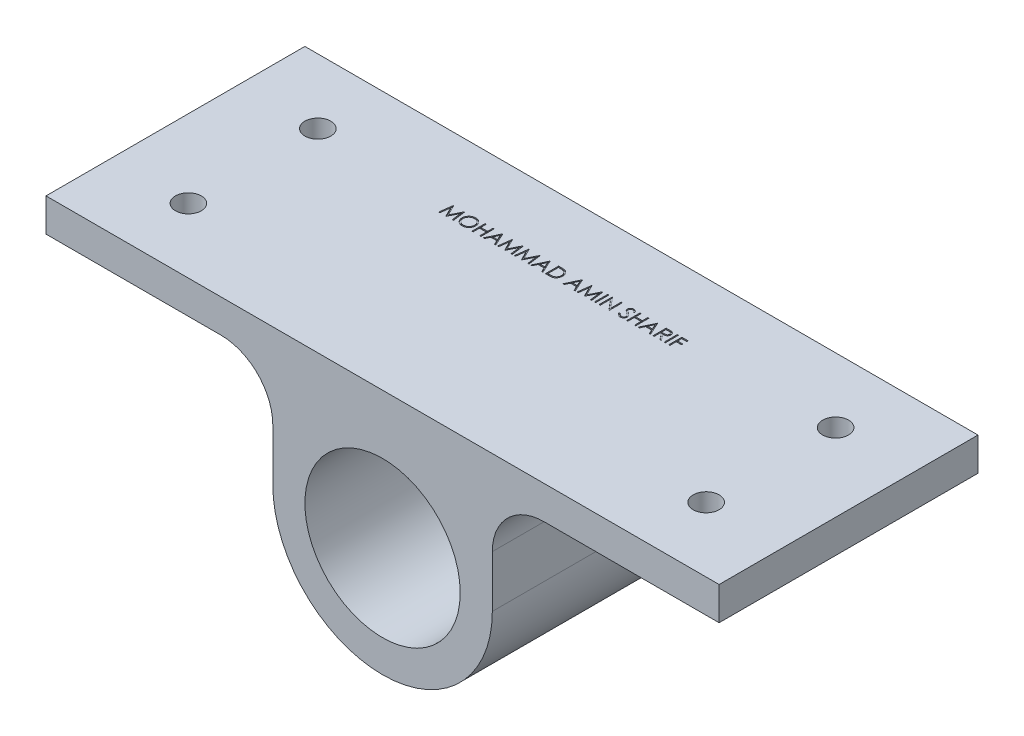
SolidWorks part; units mm, degrees
ref_plane "Front Plane" through (0, 0, 0) normal (0, 0, 1) x (1, 0, 0)
ref_plane "Top Plane" through (0, 0, 0) normal (0, 1, 0) x (1, 0, 0)
ref_plane "Right Plane" through (0, 0, 0) normal (1, 0, 0) x (0, 0, -1)
sketch "Sketch1" plane through (0, 0, 0) normal (0, 0, 1) x (1, 0, 0)
  line L0 (-325, 0) -> (325, 0)
  line L1 (325, 0) -> (325, -32)
  line L2 (325, -32) -> (156, -32)
  line L3 (106, -82) -> (106, -132)
  line L5 (-106, -132) -> (-106, -82)
  line L6 (-156, -32) -> (-325, -32)
  line L7 (-325, -32) -> (-325, 0)
  arc A0 (-106, -132) -> (106, -132) centre (0, -132) ccw
  arc A1 (156, -32) -> (106, -82) centre (156, -82) ccw
  arc A2 (-106, -82) -> (-156, -32) centre (-156, -82) ccw
  point P4 (0, 0)
  point P8 (106, -37.353)
  dimension "D3" = 212
  dimension "D6" = 50
  dimension "D1" = 650
  dimension "D2" = 212
  dimension "D4" = 132
  dimension "D5" = 32
extrude "Boss-Extrude1" add sketch "Sketch1" along normal mid plane 250
sketch "Sketch2" plane through (0, 0, 125) normal (0, 0, 1) x (1, 0, 0)
  circle A0 centre (0, -132) radius 75
  dimension "D1" = 150
extrude "Cut-Extrude1" cut sketch "Sketch2" against normal up to surface (250 mm away)
sketch "Sketch3" plane through (0, 0, 0) normal (0, 1, 0) x (1, 0, 0)
  line L0 (0, 0) -> (50000, 0) construction
  line L1 (0, 0) -> (0, 50000) construction
  line L2 (325, 125) -> (-325, 125) construction
  circle A0 centre (250, 62.5) radius 12.5
  circle A1 centre (-250, 62.5) radius 12.5
  circle A2 centre (250, -62.5) radius 12.5
  circle A3 centre (-250, -62.5) radius 12.5
  dimension "D1" = 25
  dimension "D2" = 62.5
  dimension "D3" = 62.5
  dimension "D4" = 250
extrude "Cut-Extrude2" cut sketch "Sketch3" against normal up to surface (32 mm away)
sketch "Sketch6" plane through (0, 0, 0) normal (0, 1, 0) x (1, 0, 0)
  text T0 "MOHAMMAD AMIN SHARIF" font "Century Gothic" height in points 48
extrude "Cut-Extrude3" cut sketch "Sketch6" against normal blind 1
